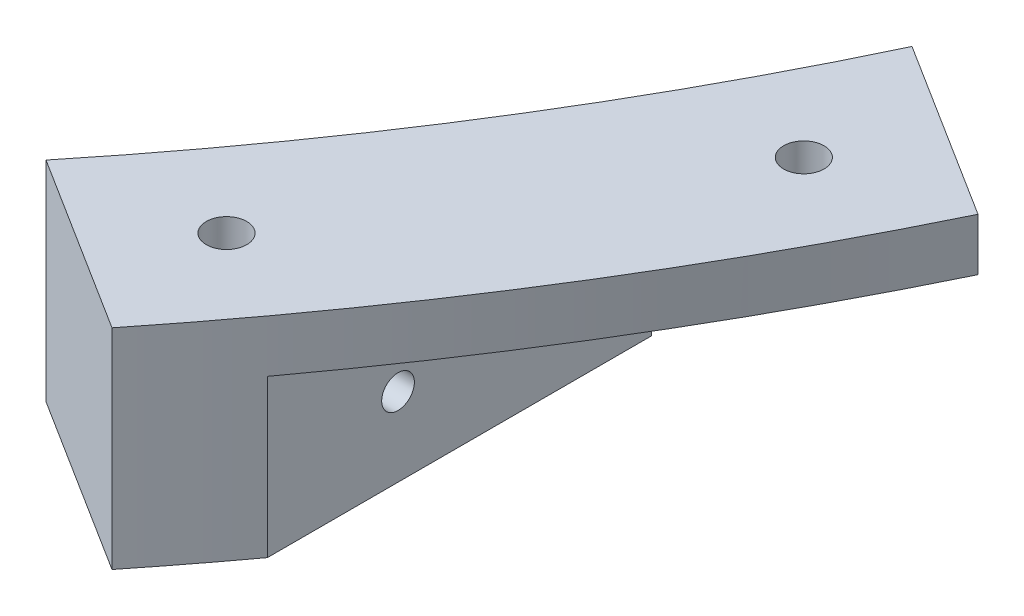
SolidWorks part; units mm, degrees
ref_plane "XY Plane" through (0, 0, 0) normal (0, 0, 1) x (1, 0, 0)
ref_plane "XZ Plane" through (0, 0, 0) normal (0, 1, 0) x (1, 0, 0)
ref_plane "YZ Plane" through (0, 0, 0) normal (1, 0, 0) x (0, 0, -1)
ref_plane "Plane1" through (0, -80.9625, 0) normal (0, -1, 0) x (1, 0, 0)
sketch "Sketch1" plane through (0, -80.9625, 0) normal (0, -1, 0) x (1, 0, 0)
  line L0 (574.035, 271.4937) -> (617.3091, 298.7493)
  line L1 (536.0892, 427.7032) -> (492.8151, 400.4476)
  arc A0 (492.8151, 400.4476) -> (574.035, 271.4937) centre (0, 0) cw
  arc A1 (617.3091, 298.7493) -> (536.0892, 427.7032) centre (0, 0) ccw
extrude "Boss-Extrude1" add sketch "Sketch1" against normal blind 50.8
sketch "Sketch2" plane through (0, -80.9625, 0) normal (0, -1, 0) x (1, 0, 0)
  line L0 (552.45, 406.3504) -> (552.45, 313.0878)
  line L1 (574.035, 271.4937) -> (617.3091, 298.7493)
  arc A0 (617.3091, 298.7493) -> (552.45, 406.3504) centre (0, 0) ccw
  arc A1 (552.45, 313.0878) -> (574.035, 271.4937) centre (0, 0) cw
extrude "Cut-Extrude1" cut sketch "Sketch2" against normal blind 38.1
hole_wizard "3/8 Clearance Hole1" positions "Sketch4" profile "Sketch3" hole size "3/8" standard "ANSI Inch"
sketch "Sketch4" plane through (0, -80.9625, 0) normal (0, -1, 0) x (-1, 0, 0)
  point P0 (-530.071, -393.8945)
sketch "Sketch3" plane through (530.071, -80.9625, 393.8945) normal (1, 0, 0) x (0, 0, -1)
  line L0 (0, 0) -> (0, 50.8)
  line L1 (0, 50.8) -> (4.9022, 50.8)
  line L2 (4.9022, 50.8) -> (4.9022, 0)
  line L5 (4.9022, 0) -> (0, 0)
  line L11 (0, -6.35) -> (0, 107.95) construction
  dimension "Thru Hole Dia." = 9.8044
  dimension "Thru Hole Depth" = 50.8
hole_wizard "3/8 Clearance Hole2" positions "Sketch6" profile "Sketch5" hole size "3/8" standard "ANSI Inch"
sketch "Sketch6" plane through (0, -30.1625, 0) normal (0, 1, 0) x (1, 0, 0)
  point P0 (584.2176, -307.9253)
sketch "Sketch5" plane through (584.2176, -30.1625, 307.9253) normal (1, 0, 0) x (0, 0, 1)
  line L0 (0, 0) -> (0, 50.8)
  line L1 (0, 50.8) -> (4.9022, 50.8)
  line L2 (4.9022, 50.8) -> (4.9022, 0)
  line L5 (4.9022, 0) -> (0, 0)
  line L11 (0, -6.35) -> (0, 107.95) construction
  dimension "Thru Hole Dia." = 9.8044
  dimension "Thru Hole Depth" = 50.8
hole_wizard "3/8-16 Tapped Hole1" positions "Sketch8" profile "Sketch7" tap size "3/8-16" standard "ANSI Inch"
sketch "Sketch8" plane through (552.45, 0, 0) normal (1, 0, 0) x (0, 0, -1)
  point P0 (-374.65, -61.9125)
sketch "Sketch7" plane through (552.45, -61.9125, 374.65) normal (0, 1, 0) x (0, 0, -1)
  line L0 (0, 0) -> (0, 59.6349)
  line L1 (0, 59.6349) -> (3.9687, 59.6349)
  line L2 (3.9687, 59.6349) -> (3.9687, 0)
  line L5 (3.9687, 0) -> (0, 0)
  line L11 (0, -6.35) -> (0, 107.95) construction
  dimension "Thread Major Dia." = 7.9375
  dimension "Thru Tap Drill Depth" = 59.6349
hole_wizard "3/8-16 Tapped Hole2" positions "Sketch10" profile "Sketch9" tap size "3/8-16" standard "ANSI Inch"
sketch "Sketch10" plane through (552.45, 0, 0) normal (1, 0, 0) x (0, 0, -1)
  point P0 (-349.25, -61.9125)
sketch "Sketch9" plane through (552.45, -61.9125, 349.25) normal (0, 1, 0) x (0, 0, -1)
  line L0 (0, 0) -> (0, 59.6349)
  line L1 (0, 59.6349) -> (3.9687, 59.6349)
  line L2 (3.9687, 59.6349) -> (3.9687, 0)
  line L5 (3.9687, 0) -> (0, 0)
  line L11 (0, -6.35) -> (0, 107.95) construction
  dimension "Thread Major Dia." = 7.9375
  dimension "Thru Tap Drill Depth" = 59.6349
